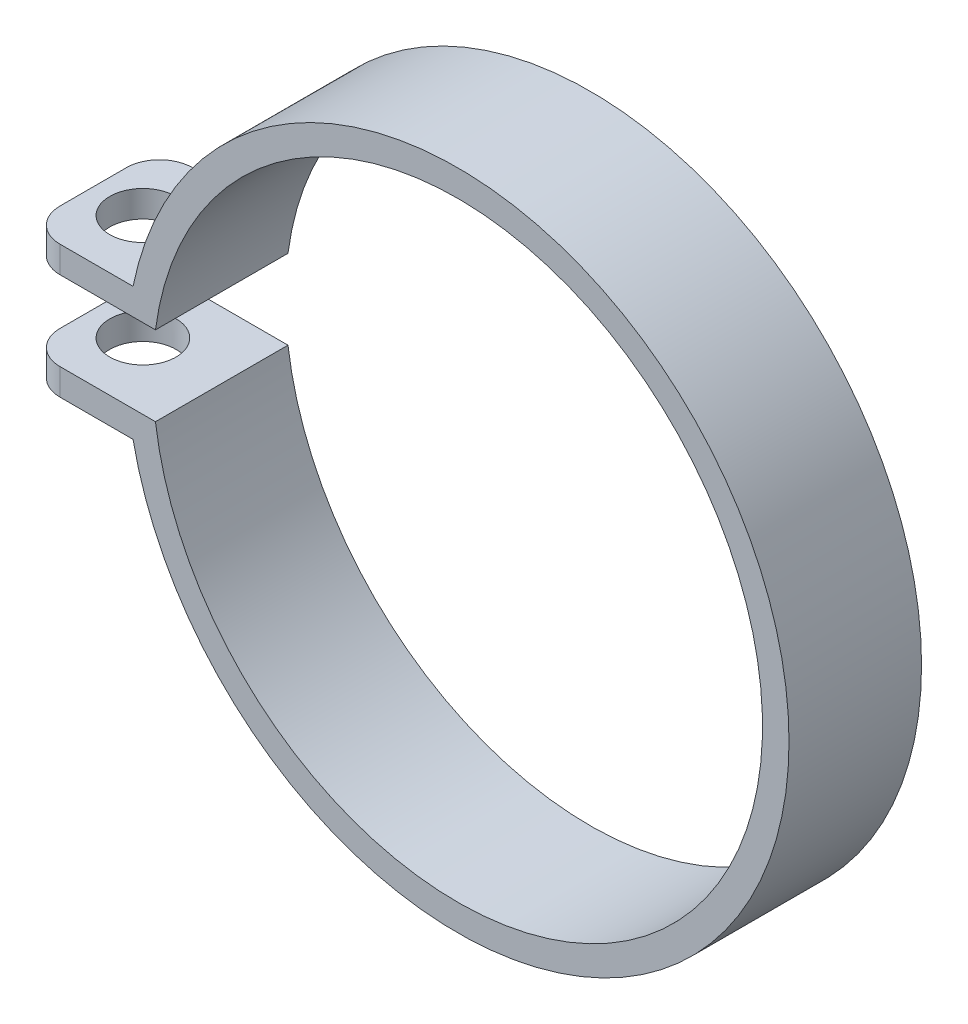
SolidWorks part; units mm, degrees
ref_plane "Front Plane" through (0, 0, 0) normal (0, 0, 1) x (1, 0, 0)
ref_plane "Top Plane" through (0, 0, 0) normal (0, 1, 0) x (1, 0, 0)
ref_plane "Right Plane" through (0, 0, 0) normal (1, 0, 0) x (0, 0, -1)
sketch "Sketch1" plane through (0, 0, 0) normal (0, 0, 1) x (1, 0, 0)
  line L0 (-65, 10) -> (-48.9898, 10)
  line L1 (0, 0) -> (-67.7688, 0) construction
  line L2 (-48.9898, -10) -> (-65, -10)
  line L3 (-45.607, -6) -> (-65, -6)
  line L4 (-65, 6) -> (-45.607, 6)
  line L5 (-65, 6) -> (-65, 10)
  line L6 (-65, -10) -> (-65, -6)
  arc A0 (-48.9898, -10) -> (-48.9898, 10) centre (0, 0) ccw
  arc A1 (-45.607, -6) -> (-45.607, 6) centre (0, 0) ccw
  dimension "D2" = 50
  dimension "D1" = 20
  dimension "D3" = 65
  dimension "D4" = 4
extrude "Boss-Extrude1" add sketch "Sketch1" along normal mid plane 20
fillet "Fillet1" radius 5 4 edges at (-65, -8, 10) (-65, -8, -10) (-65, 8, -10) (-65, 8, 10)
sketch "Sketch2" plane through (0, 10, 0) normal (0, 1, 0) x (1, 0, 0)
  line L0 (-65, -5) -> (-65, 5) construction
  circle A0 centre (-57.5, 0) radius 5
  dimension "D1" = 7.5
  dimension "D2" = 10
extrude "Cut-Extrude1" cut sketch "Sketch2" against normal up to surface (20 mm away)
